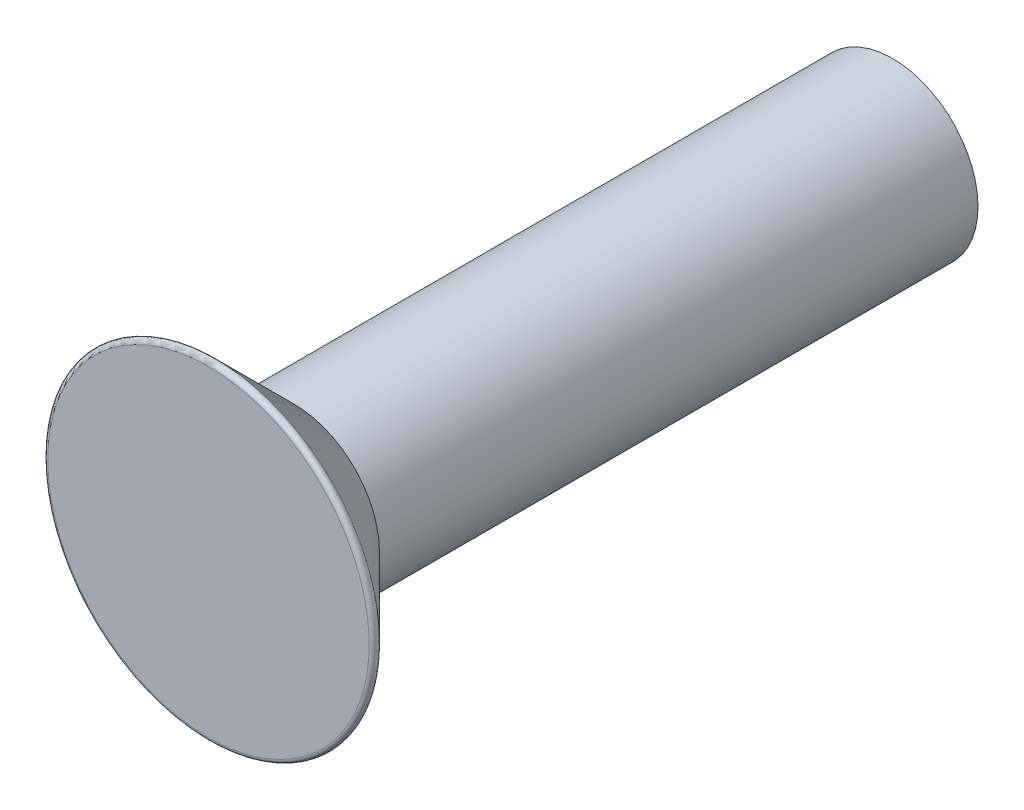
SolidWorks part; units mm, degrees
ref_plane "Front Plane" through (0, 0, 0) normal (0, 0, 1) x (1, 0, 0)
ref_plane "Top Plane" through (0, 0, 0) normal (0, 1, 0) x (1, 0, 0)
ref_plane "Right Plane" through (0, 0, 0) normal (1, 0, 0) x (0, 0, -1)
other "Configuration Table"
sketch "BaseBodySke" plane through (0, 0, 0) normal (0, 1, 0) x (1, 0, 0)
  line L0 (0, 0) -> (-6.35, 0)
  line L1 (0, 0) -> (0, 32.7778) construction
  line L2 (0, 0) -> (0, 25.4)
  line L3 (0, 25.4) -> (-3.175, 25.4)
  line L4 (-3.175, 3.175) -> (-3.175, 25.4)
  line L5 (-6.35, 25.4) -> (-6.35, 0) construction
  line L6 (-6.35, -3.175) -> (-6.35, 0) construction
  line L7 (-6.35, 0) -> (-3.175, 3.175)
  line L9 (-3.175, 3.175) -> (-3.175, 0) construction
revolve "BaseBody" add sketch "BaseBodySke" angle 360 about L1
fillet "Fillet" radius 0.1588 1 edges at (6.35, 0, 0)
equation "\"D1@Fillet\" = \"Diameter@BaseBodySke\" / 40"
